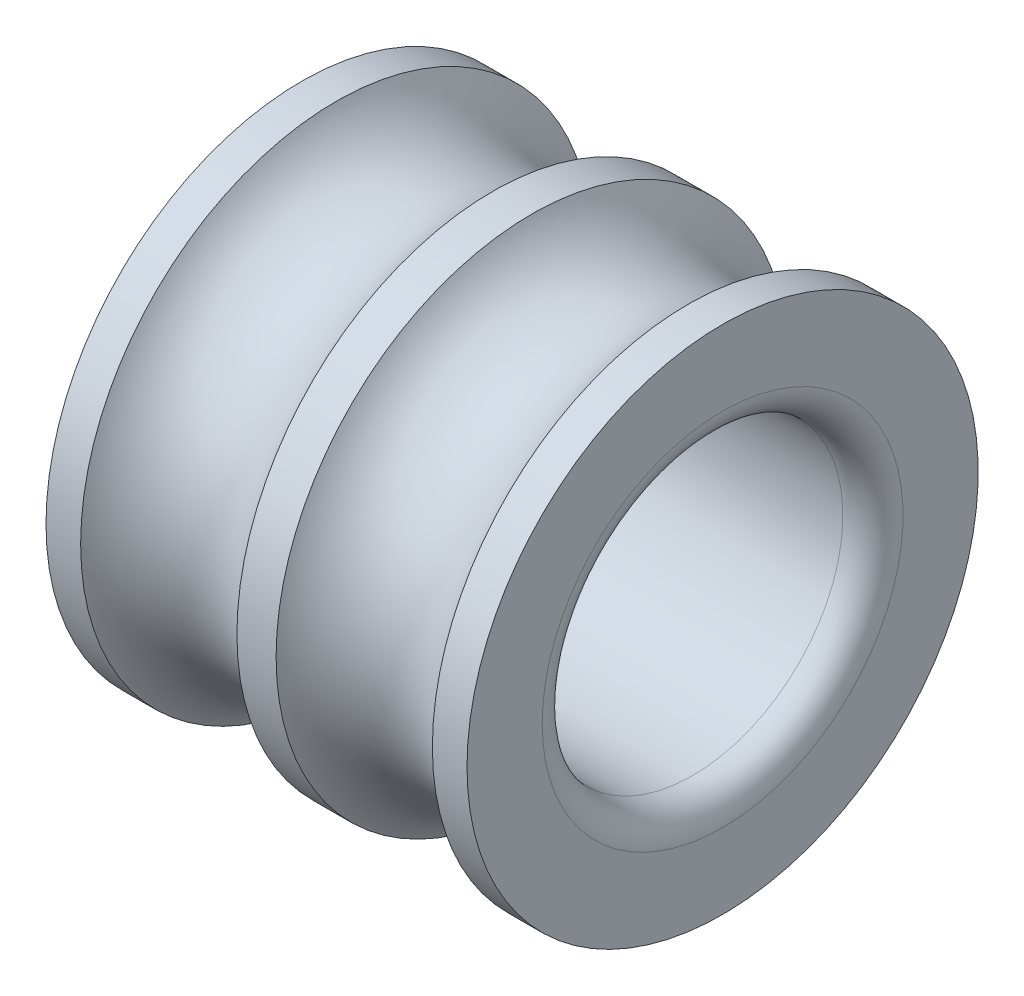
SolidWorks part; units mm, degrees
ref_plane "Plan1" through (0, 0, 0) normal (0, 0, 1) x (1, 0, 0)
ref_plane "Plan2" through (0, 0, 0) normal (0, 1, 0) x (1, 0, 0)
ref_plane "Plan3" through (0, 0, 0) normal (1, 0, 0) x (0, 0, -1)
sketch "Esquisse1" plane through (0, 0, 0) normal (0, 0, 1) x (1, 0, 0)
  line L0 (0, 0) -> (30.1449, 0) construction
  line L1 (0, 5) -> (14, 5)
  line L2 (14, 5) -> (14, 8.5)
  line L3 (14, 8.5) -> (12.8481, 8.5)
  line L4 (0, 8.5) -> (0, 5)
  line L5 (7.6519, 8.5) -> (6.3481, 8.5)
  line L6 (1.1519, 8.5) -> (0, 8.5)
  arc A0 (1.1519, 8.5) -> (6.3481, 8.5) centre (3.75, 10) ccw
  arc A1 (7.6519, 8.5) -> (12.8481, 8.5) centre (10.25, 10) ccw
  dimension "D1" = 6
  dimension "D2" = 10
  dimension "D6" = 6
  dimension "D7" = 6.5
  dimension "D8" = 3.75
  dimension "D3" = 14
  dimension "D4" = 5
  dimension "D5" = 3.5
revolve "Base-Révolution" add sketch "Esquisse1" angle 360 about L0
fillet "Congé1" radius 1 2 edges at (14, 0, 5) (0, 0, 5)
sketch "Esq_WRNL_Compact001" plane through (0, 0, 0) normal (0, 0, 1) x (1, 0, 0)
  line L0 (-1, -9.5) -> (-1, 9.5)
  line L1 (15, -9.5) -> (15, 9.5)
  line L2 (-1, -9.5) -> (15, -9.5)
  line L3 (-1, 9.5) -> (15, 9.5)
